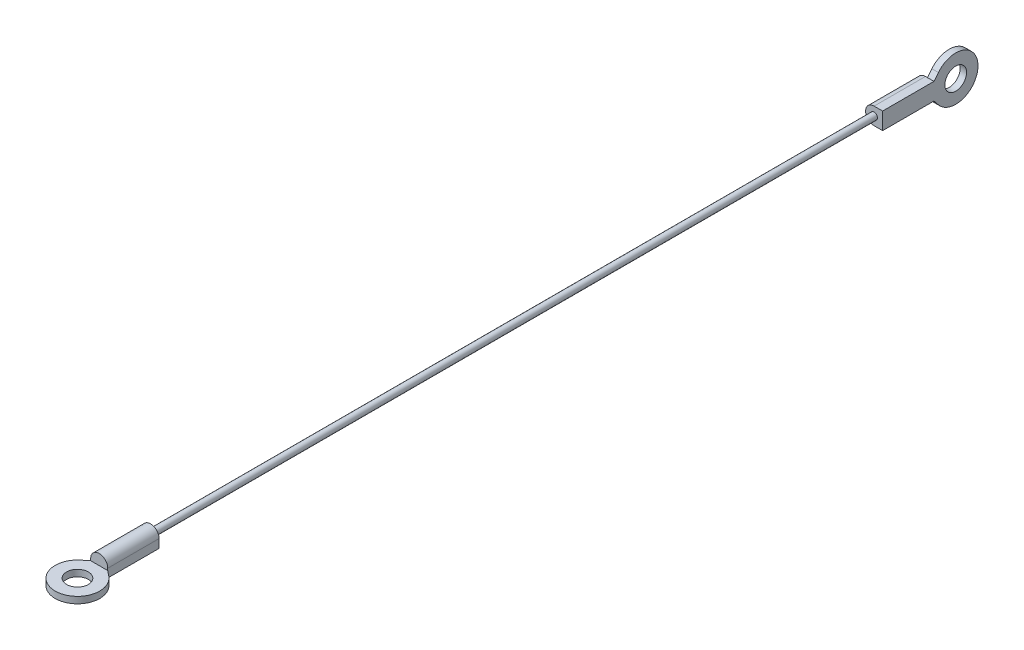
SolidWorks part; units mm, degrees
ref_plane "Front Plane" through (0, 0, 0) normal (0, 0, 1) x (1, 0, 0)
ref_plane "Top Plane" through (0, 0, 0) normal (0, 1, 0) x (1, 0, 0)
ref_plane "Right Plane" through (0, 0, 0) normal (1, 0, 0) x (0, 0, -1)
sketch "Sketch1" plane through (0, 0, 0) normal (0, 0, 1) x (1, 0, 0)
  circle A0 centre (0, 0) radius 0.795
extrude "Boss-Extrude1" add sketch "Sketch1" along normal mid plane 169.04
sketch "Sketch2" plane through (0, 0, 84.52) normal (0, 0, 1) x (1, 0, 0)
  line L0 (-1.99, 0) -> (-1.99, -1.99)
  line L1 (-1.99, -1.99) -> (0, -1.99)
  line L2 (0, -1.99) -> (1.99, -1.99)
  line L3 (1.99, -1.99) -> (1.99, 0)
  arc A0 (1.99, 0) -> (-1.99, 0) centre (0, 0) ccw
  dimension "D1" = 3.98
extrude "Boss-Extrude2" add sketch "Sketch2" along normal blind 12
sketch "Sketch3" plane through (0, -1.99, 0) normal (0, -1, 0) x (1, 0, 0)
  line L0 (1.99, 96.52) -> (3.2639, 97.5455)
  line L1 (-3.2639, 97.5455) -> (-1.99, 96.52)
  line L2 (-1.99, 96.52) -> (1.99, 96.52)
  arc A0 (3.2639, 97.5455) -> (-3.2639, 97.5455) centre (0, 101.6) ccw
  circle A1 centre (0, 101.6) radius 2.54
  point P8 (5.205, 101.6)
  point P9 (-5.205, 101.6)
  dimension "D1" = 5.08
  dimension "D2" = 10.41
  dimension "D3" = 101.6
extrude "Boss-Extrude3" add sketch "Sketch3" against normal blind 1.52
sketch "Sketch4" plane through (0, 0, -84.52) normal (0, 0, -1) x (-1, 0, 0)
  line L0 (0, 1.99) -> (-1.99, 1.99)
  line L1 (-1.99, 1.99) -> (-1.99, 0)
  line L2 (-1.99, 0) -> (-1.99, -1.99)
  line L3 (-1.99, -1.99) -> (0, -1.99)
  arc A0 (0, -1.99) -> (0, 1.99) centre (0, 0) ccw
  dimension "D1" = 3.98
extrude "Boss-Extrude4" add sketch "Sketch4" along normal blind 12
sketch "Sketch5" plane through (1.99, 0, 0) normal (1, 0, 0) x (0, 0, -1)
  line L0 (96.52, -1.99) -> (96.52, 1.99)
  line L1 (96.52, 1.99) -> (97.5455, 3.2639)
  line L2 (97.5455, -3.2639) -> (96.52, -1.99)
  arc A0 (97.5455, 3.2639) -> (97.5455, -3.2639) centre (101.6, 0) cw
  circle A1 centre (101.6, 0) radius 2.54
  point P8 (101.6, 5.205)
  point P9 (101.6, -5.205)
  dimension "D1" = 5.08
  dimension "D2" = 10.41
  dimension "D3" = 101.6
extrude "Boss-Extrude5" add sketch "Sketch5" against normal blind 1.52
